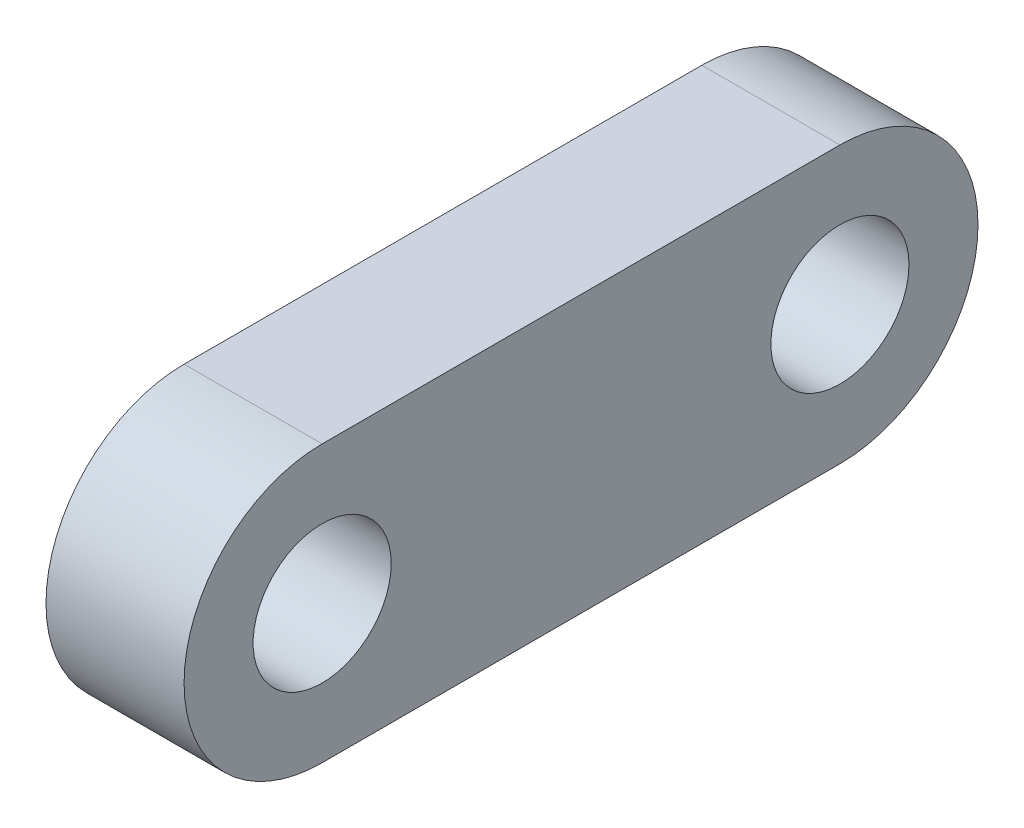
SolidWorks part; units mm, degrees
ref_plane "Front Plane" through (0, 0, 0) normal (0, 0, 1) x (1, 0, 0)
ref_plane "Top Plane" through (0, 0, 0) normal (0, 1, 0) x (1, 0, 0)
ref_plane "Right Plane" through (0, 0, 0) normal (1, 0, 0) x (0, 0, -1)
sketch "Sketch1" plane through (0, 0, 0) normal (1, 0, 0) x (0, 0, -1)
  line L0 (-75, 0) -> (75, 0) construction
  line L1 (-75, 40) -> (75, 40)
  line L2 (-75, -40) -> (75, -40)
  arc A0 (-75, 40) -> (-75, -40) centre (-75, 0) ccw
  arc A1 (75, -40) -> (75, 40) centre (75, 0) ccw
  circle A2 centre (-75, 0) radius 20
  circle A3 centre (75, 0) radius 20
  point P2 (0, 0)
  dimension "D2" = 40
  dimension "D3" = 40
  dimension "D4" = 40
  dimension "D1" = 150
extrude "Boss-Extrude1" add sketch "Sketch1" along normal mid plane 40
